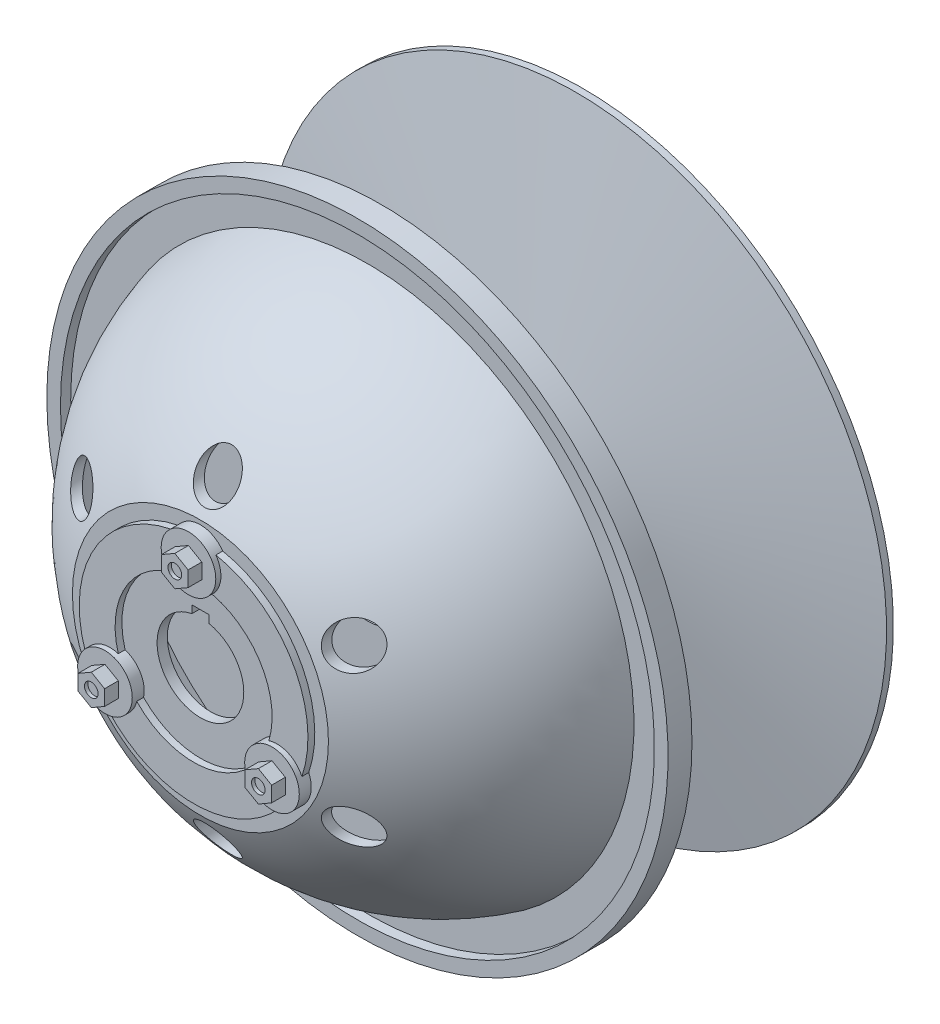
SolidWorks part; units mm, degrees
ref_plane "Alzado" through (0, 0, 0) normal (0, 0, 1) x (1, 0, 0)
ref_plane "Planta" through (0, 0, 0) normal (0, 1, 0) x (1, 0, 0)
ref_plane "Vista lateral" through (0, 0, 0) normal (1, 0, 0) x (0, 0, -1)
sketch "Croquis1" plane through (0, 0, 0) normal (1, 0, 0) x (0, 0, -1)
  line L0 (0, 0) -> (0, 91)
  line L1 (0, 91) -> (-2, 91)
  line L2 (-59, 91) -> (-66, 91)
  line L3 (-66, 91) -> (-66, 87)
  line L4 (-15, 17.5) -> (-2, 91)
  line L5 (-15, 17.5) -> (-44, 17.5)
  line L6 (-66, 87) -> (-63, 87)
  line L7 (-63, 87) -> (-63, 78)
  line L8 (-59, 91) -> (-44, 17.5)
  line L9 (0, 0) -> (-112, 0)
  line L10 (-112, 0) -> (-112, 37.5)
  arc A0 (-112, 37.5) -> (-63, 78) centre (-43.316, 4.2929) cw
  dimension "D1" = 91
  dimension "D2" = 2
  dimension "D3" = 7
  dimension "D4" = 4
  dimension "D5" = 29
  dimension "D6" = 3
  dimension "D7" = 9
  dimension "D8" = 37.5
revolve "Revolución1" add sketch "Croquis1" angle 360 about L9
sketch "Croquis2" plane through (0, 0, 112) normal (0, 0, 1) x (1, 0, 0)
  circle A0 centre (0, 0) radius 33.5
  circle A1 centre (0, 0) radius 23
extrude "Extruir1" add sketch "Croquis2" along normal blind 2
sketch "Croquis3" plane through (0, 0, 112) normal (0, 0, 1) x (1, 0, 0)
  circle A0 centre (24.4652, -14.125) radius 8
  circle A1 centre (0, 28.25) radius 8
  circle A2 centre (-24.4652, -14.125) radius 8
extrude "Extruir2" add sketch "Croquis3" along normal blind 3.5
sketch "Croquis4" plane through (0, 0, 115.5) normal (0, 0, 1) x (1, 0, 0)
  line L0 (20.5704, -16.3737) -> (20.5704, -11.8763)
  line L1 (24.4652, -18.6223) -> (20.5704, -16.3737)
  line L2 (28.36, -16.3737) -> (24.4652, -18.6223)
  line L3 (28.36, -11.8763) -> (28.36, -16.3737)
  line L4 (24.4652, -9.6277) -> (28.36, -11.8763)
  line L5 (-3.8948, 30.4987) -> (0, 32.7473)
  line L6 (0, 32.7473) -> (3.8948, 30.4987)
  line L7 (3.8948, 26.0013) -> (0, 23.7527)
  line L8 (0, 23.7527) -> (-3.8948, 26.0013)
  line L9 (-3.8948, 26.0013) -> (-3.8948, 30.4987)
  line L10 (3.8948, 30.4987) -> (3.8948, 26.0013)
  line L11 (20.5704, -11.8763) -> (24.4652, -9.6277)
  line L12 (-24.4652, -9.6277) -> (-20.5704, -11.8763)
  line L13 (-28.36, -11.8763) -> (-24.4652, -9.6277)
  line L14 (-28.36, -16.3737) -> (-28.36, -11.8763)
  line L15 (-24.4652, -18.6223) -> (-28.36, -16.3737)
  line L16 (-20.5704, -16.3737) -> (-24.4652, -18.6223)
  line L17 (-20.5704, -11.8763) -> (-20.5704, -16.3737)
extrude "Extruir3" add sketch "Croquis4" along normal blind 4
sketch "Croquis5" plane through (0, 0, 119.5) normal (0, 0, 1) x (1, 0, 0)
  circle A0 centre (0, 28.25) radius 2
  circle A1 centre (0, 28.25) radius 4.4973
  circle A2 centre (24.4652, -14.125) radius 2
  circle A3 centre (-24.4652, -14.125) radius 2
extrude "Cortar-Extruir1" cut sketch "Croquis5" against normal blind 1 contours A0 | A2 | A3
sketch "Croquis6" plane through (0, 0, 112) normal (0, 0, 1) x (1, 0, 0)
  circle A1 centre (0, 46) radius 6
  circle A2 centre (39.8372, 23) radius 6
  circle A3 centre (39.8372, -23) radius 6
  circle A4 centre (0, -46) radius 6
  circle A5 centre (-39.8372, -23) radius 6
  circle A6 centre (-39.8372, 23) radius 6
extrude "Cortar-Extruir2" cut sketch "Croquis6" against normal blind 45
sketch "Croquis7" plane through (0, 0, 112) normal (0, 0, 1) x (1, 0, 0)
  line L1 (-2.5, 14.7) -> (2.5, 14.7)
  line L2 (2.5, 14.7) -> (2.5, 12.4515)
  line L3 (-2.5, 14.7) -> (-2.5, 12.4515)
  arc A3 (-2.5, 12.4515) -> (2.5, 12.4515) centre (0, 0) ccw
extrude "Cortar-Extruir3" cut sketch "Croquis7" against normal through all
ref_plane "Plano1" through (0, 0, 0) normal (1, 0, 0) x (0, 0, -1)
sketch "Croquis9" plane through (0, 0, 0) normal (1, 0, 0) x (0, 0, -1)
  line L1 (-109, 6.4731) -> (-63, 6.4731)
  line L3 (-63, 75) -> (-63, 6.4731)
  line L5 (-112, -0.1242) -> (0, -0.1242) construction
  line L7 (-109, 37.5) -> (-109, 6.4731)
  line L8 (-112, 12.4515) -> (-112, -12.7) construction
  line L9 (0, -12.7) -> (0, 12.4515) construction
  arc A3 (-63, 75) -> (-109, 37.5) centre (-42.2469, 2.5795) ccw
revolve "Cortar-Revolución1" cut sketch "Croquis9" angle 360 about L5
